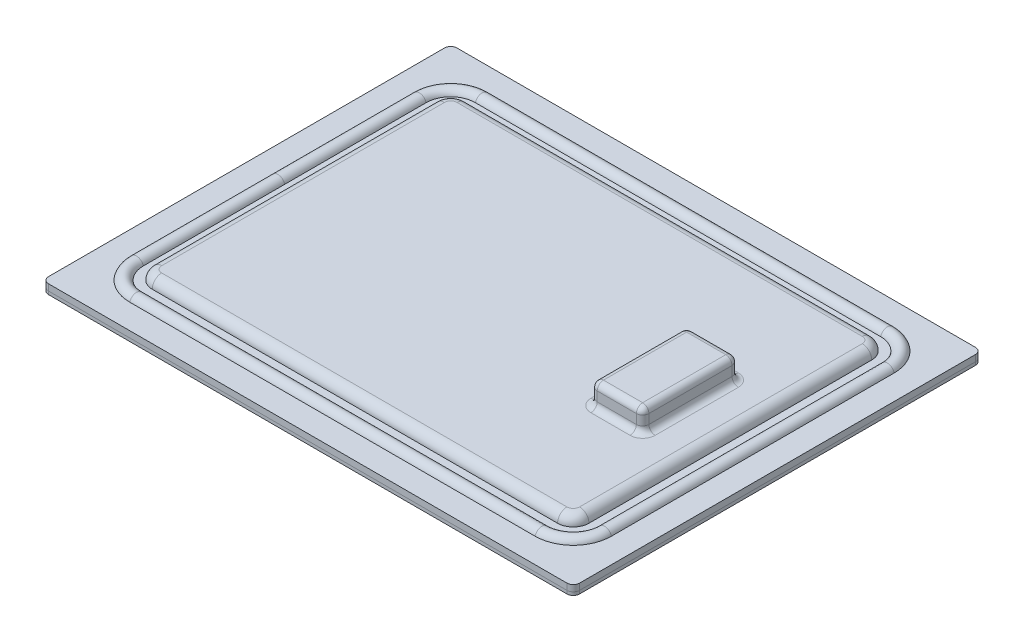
SolidWorks part; units mm, degrees
ref_plane "Front Plane" through (0, 0, 0) normal (0, 0, 1) x (1, 0, 0)
ref_plane "Top Plane" through (0, 0, 0) normal (0, 1, 0) x (1, 0, 0)
ref_plane "Right Plane" through (0, 0, 0) normal (1, 0, 0) x (0, 0, -1)
sketch "Esquisse1" plane through (0, 0, 0) normal (0, 1, 0) x (1, 0, 0)
  line L2 (-84.5, 65) -> (-84.5, -65)
  line L3 (-84.5, -65) -> (84.5, -65)
  line L4 (84.5, 65) -> (84.5, -65)
  line L55 (-84.5, 65) -> (84.5, 65)
  point P4 (-84.5, 0)
  point P6 (0, -65)
  dimension "D1" = 169
  dimension "D2" = 130
extrude "Verre" add sketch "Esquisse1" along normal blind 1
sketch "Esquisse6" plane through (0, 1, 0) normal (0, -1, 0) x (-1, 0, 0)
  line L1 (-64.5, 50) -> (64.5, 50)
  line L2 (-69.5, 45) -> (-69.5, -45)
  line L3 (-64.5, -50) -> (64.5, -50)
  line L4 (69.5, 45) -> (69.5, -45)
  line L8 (84.5, 65) -> (84.5, -65) construction
  line L9 (-84.5, 65) -> (84.5, 65) construction
  arc A4 (69.5, 45) -> (64.5, 50) centre (64.5, 45) ccw
  arc A5 (-64.5, 50) -> (-69.5, 45) centre (-64.5, 45) ccw
  arc A6 (-69.5, -45) -> (-64.5, -50) centre (-64.5, -45) ccw
  arc A7 (64.5, -50) -> (69.5, -45) centre (64.5, -45) ccw
  point P7 (0, 50)
  point P8 (69.5, 0)
extrude "Boss.-Extru.4" add sketch "Esquisse6" against normal blind 5 separate body
fillet "Congé2" radius 3 8 edges at (69.5, 6, 0) (68.0355, 6, 48.5355) (0, 6, 50) (-68.0355, 6, 48.5355) (-69.5, 6, 0) (-68.0355, 6, -48.5355) (0, 6, -50) (68.0355, 6, -48.5355)
shell "Fond" thickness 2
sketch "Esquisse12" plane through (0, 1, 0) normal (0, 1, 0) x (1, 0, 0)
  line L0 (-64.5, 50) -> (64.5, 50)
  line L1 (-84.5, 65) -> (84.5, 65)
  line L2 (-84.5, 65) -> (-84.5, -65)
  line L3 (-84.5, -65) -> (84.5, -65)
  line L4 (84.5, 65) -> (84.5, -65)
  line L5 (69.5, 45) -> (69.5, -45)
  line L6 (64.5, -50) -> (-64.5, -50)
  line L7 (-69.5, -45) -> (-69.5, 45)
  line L8 (84.5, -65) -> (84.5, 65) construction
  line L9 (84.5, 65) -> (84.5, -65) construction
  arc A0 (69.5, 45) -> (64.5, 50) centre (64.5, 45) ccw construction
  arc A1 (64.5, 50) -> (69.5, 45) centre (64.5, 45) cw
  arc A2 (69.5, -45) -> (64.5, -50) centre (64.5, -45) cw
  arc A3 (-64.5, -50) -> (-69.5, -45) centre (-64.5, -45) cw
  arc A4 (-69.5, 45) -> (-64.5, 50) centre (-64.5, 45) cw
extrude "Plaque" add sketch "Esquisse12" along normal blind 2 separate body
sketch "Esquisse13" plane through (0, 4, 0) normal (0, -1, 0) x (1, 0, 0)
  line L1 (-50.2982, 34.144) -> (50.2982, 34.144)
  line L2 (-50.2982, 34.144) -> (-50.2982, -34.144)
  line L3 (-50.2982, -34.144) -> (50.2982, -34.144)
  line L4 (50.2982, 34.144) -> (50.2982, -34.144)
  line L5 (-50.2982, 34.144) -> (50.2982, -34.144) construction
  line L6 (-50.2982, -34.144) -> (50.2982, 34.144) construction
  point P0 (0, 0)
extrude "Boss.-Extru.6" add sketch "Esquisse13" along normal blind 1
sketch "Esquisse8" plane through (0, 3, 0) normal (0, 1, 0) x (1, 0, 0)
  line L9 (64.5, 55) -> (-64.5, 55)
  line L10 (-74.5, 45) -> (-74.5, -45)
  line L11 (-64.5, -55) -> (64.5, -55)
  line L12 (74.5, -45) -> (74.5, 45)
  line L13 (64.5, 55) -> (-64.5, 55)
  line L14 (-74.5, 45) -> (-74.5, -45)
  line L15 (-64.5, -55) -> (64.5, -55)
  line L16 (74.5, -45) -> (74.5, 45)
  arc A8 (-64.5, 55) -> (-74.5, 45) centre (-64.5, 45) ccw
  arc A9 (-64.5, 55) -> (-74.5, 45) centre (-64.5, 45) ccw
  arc A10 (-74.5, -45) -> (-64.5, -55) centre (-64.5, -45) ccw
  arc A11 (-74.5, -45) -> (-64.5, -55) centre (-64.5, -45) ccw
  arc A13 (64.5, -55) -> (74.5, -45) centre (64.5, -45) ccw
  arc A14 (64.5, -55) -> (74.5, -45) centre (64.5, -45) ccw
  arc A15 (74.5, 45) -> (64.5, 55) centre (64.5, 45) ccw
  arc A16 (74.5, 45) -> (64.5, 55) centre (64.5, 45) ccw
  dimension "D1" = 5
sketch "Esquisse9" plane through (0, 0, 0) normal (0, 0, 1) x (1, 0, 0)
  line L2 (-72.349, 3) -> (-76.651, 3)
  line L3 (-64.5, 3) -> (-74.5, 3) construction
  arc A0 (-72.349, 3) -> (-76.651, 3) centre (-74.5, 2.427) ccw
  point P3 (-74.5, 3)
sweep "Balayage1" add profiles "Esquisse9" path "Esquisse8"
sketch "Esquisse14" plane through (0, 6, 0) normal (0, 1, 0) x (1, 0, 0)
  line L1 (40.3508, 15.2298) -> (56.8076, 15.2298)
  line L2 (40.3508, 15.2298) -> (40.3508, -15.2298)
  line L3 (40.3508, -15.2298) -> (56.8076, -15.2298)
  line L4 (56.8076, 15.2298) -> (56.8076, -15.2298)
  line L5 (40.3508, 15.2298) -> (56.8076, -15.2298) construction
  line L6 (40.3508, -15.2298) -> (56.8076, 15.2298) construction
  point P0 (48.5792, 0)
extrude "Boss.-Extru.7" add sketch "Esquisse14" along normal blind 7
fillet "Congé3" radius 2 12 edges at (48.5792, 13, 15.2298) (40.3508, 13, 0) (48.5792, 13, -15.2298) (56.8076, 13, 0) (56.8076, 6, 0) (40.3508, 6, 0) (40.3508, 9.5, 15.2298) (56.8076, 9.5, 15.2298) (48.5792, 6, 15.2298) (56.8076, 9.5, -15.2298) (40.3508, 9.5, -15.2298) (48.5792, 6, -15.2298)
fillet "Congé4" radius 2 4 edges at (84.5, 2, -65) (84.5, 2, 65) (-84.5, 2, -65) (-84.5, 2, 65)
fillet "Congé5" radius 2 4 edges at (-84.5, 0.5, 65) (-84.5, 0.5, -65) (84.5, 0.5, 65) (84.5, 0.5, -65)
equation "\"D3@Esquisse6\"=\"D2@Esquisse6\""
